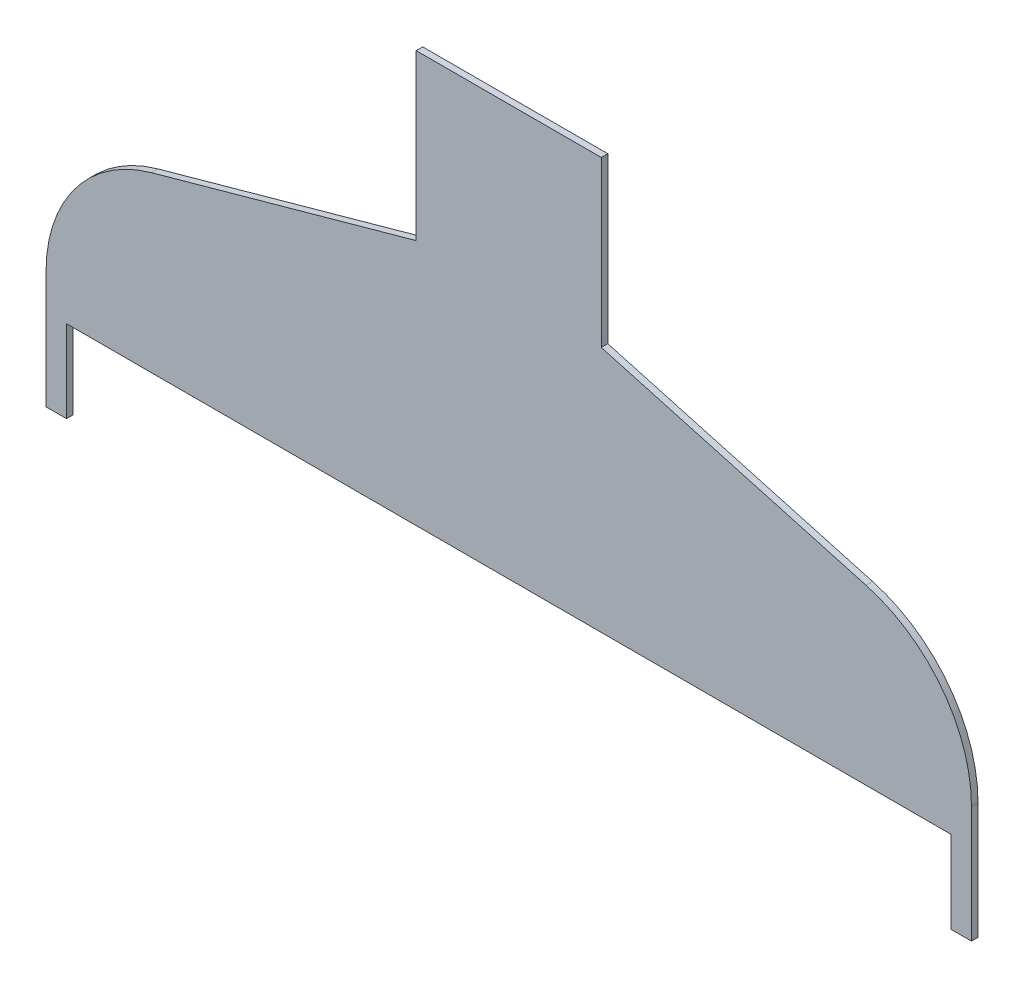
SolidWorks part; units mm, degrees
ref_plane "Front Plane" through (0, 0, 0) normal (0, 0, 1) x (1, 0, 0)
ref_plane "Top Plane" through (0, 0, 0) normal (0, 1, 0) x (1, 0, 0)
ref_plane "Right Plane" through (0, 0, 0) normal (1, 0, 0) x (0, 0, -1)
sketch "Sketch1" plane through (0, 0, 0) normal (0, 0, 1) x (1, 0, 0)
  line L0 (0, -50) -> (90, -50)
  line L1 (45, -50) -> (45, 70) construction
  line L3 (-170, -90) -> (-180, -90)
  line L4 (-180, -33.206) -> (-180, -90)
  line L5 (260, -50) -> (90, -50)
  line L6 (-170, -90) -> (-170, -50)
  line L7 (-170, -50) -> (0, -50)
  line L8 (260, -90) -> (260, -50)
  line L9 (0, 70) -> (-128.7351, 34.2403)
  line L10 (260, -90) -> (270, -90)
  line L11 (270, -33.206) -> (270, -90)
  line L12 (90, 70) -> (218.7351, 34.2403)
  line L13 (45, 70) -> (45, 150) construction
  line L14 (0, 70) -> (0, 150)
  line L15 (0, 150) -> (90, 150)
  line L16 (90, 150) -> (90, 70)
  arc A0 (-128.7351, 34.2403) -> (-180, -33.206) centre (-110, -33.206) ccw
  arc A1 (218.7351, 34.2403) -> (270, -33.206) centre (200, -33.206) cw
  point P10 (-180, 20)
  point P15 (-180, 20)
  dimension "D7" = 70
  dimension "D1" = 40
  dimension "D2" = 170
  dimension "D3" = 180
  dimension "D4" = 50
  dimension "D5" = 110
extrude "Boss-Extrude1" add sketch "Sketch1" along normal blind 3.175
